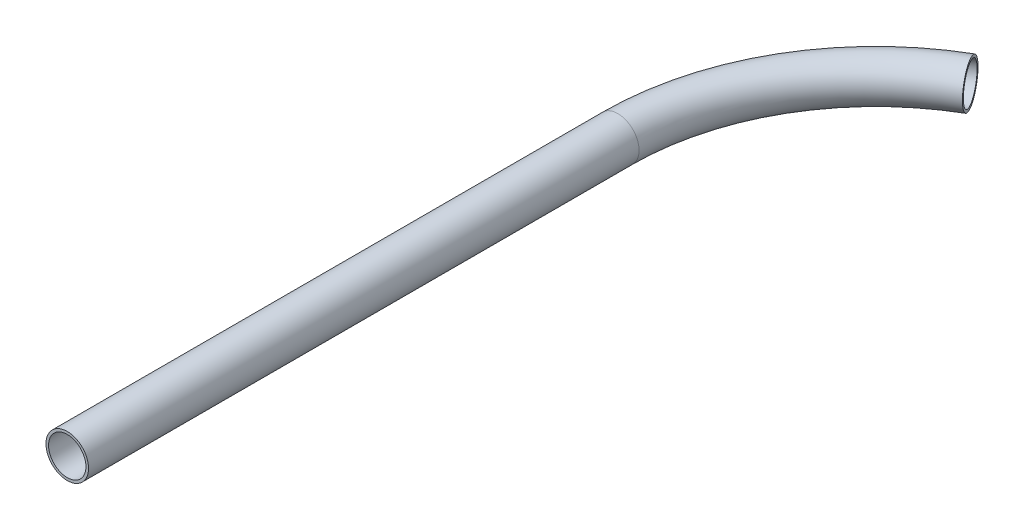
SolidWorks part; units mm, degrees
ref_plane "Plan de face" through (0, 0, 0) normal (0, 0, 1) x (1, 0, 0)
ref_plane "Plan de dessus" through (0, 0, 0) normal (0, 1, 0) x (1, 0, 0)
ref_plane "Plan de droite" through (0, 0, 0) normal (1, 0, 0) x (0, 0, -1)
sketch "Esquisse1" plane through (0, 0, 0) normal (0, 1, 0) x (1, 0, 0)
  line L0 (0, 0) -> (0, 426.7949)
  line L1 (100, 600) -> (255.0316, 689.5075) construction
  arc A0 (0, 426.7949) -> (100, 600) centre (200, 426.7949) cw
  dimension "D1" = 200
  dimension "D2" = 600
  dimension "D3" = 60
  dimension "D4" = 100
sketch "Esquisse2" plane through (0, 0, 0) normal (0, 0, 1) x (1, 0, 0)
  circle A0 centre (0, 0) radius 14.5
  circle A1 centre (0, 0) radius 16.5
  dimension "D1" = 33
  dimension "D2" = 2
sweep "Balayage1" add profiles "Esquisse2" path "Esquisse1"
ref_plane "Plan1" through (100, 0, 0) normal (1, 0, 0) x (0, 0, -1)
ref_plane "Plan2" through (0, 15, 0) normal (0, 1, 0) x (1, 0, 0)
